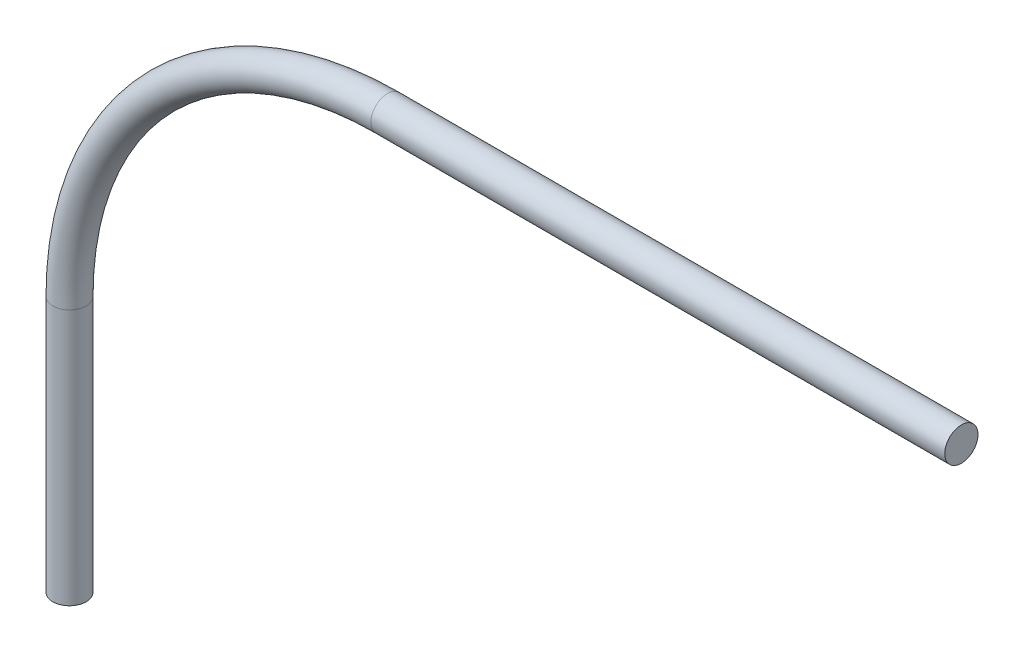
SolidWorks part; units mm, degrees
ref_plane "Front Plane" through (0, 0, 0) normal (0, 0, 1) x (1, 0, 0)
ref_plane "Top Plane" through (0, 0, 0) normal (0, 1, 0) x (1, 0, 0)
ref_plane "Right Plane" through (0, 0, 0) normal (1, 0, 0) x (0, 0, -1)
sketch "Sketch1" plane through (0, 0, 0) normal (0, 0, 1) x (1, 0, 0)
  line L0 (-57.15, 38.1) -> (-57.15, 96.7691)
  line L1 (15.6593, 169.5784) -> (147.0581, 169.5784)
  arc A0 (-57.15, 96.7691) -> (15.6593, 169.5784) centre (15.6593, 96.7691) cw
sketch "Sketch2" plane through (0, 38.1, 0) normal (0, 1, 0) x (1, 0, 0)
  circle A1 centre (-57.15, 0) radius 3.81
sweep "Sweep1" add profiles "Sketch2" path "Sketch1"
